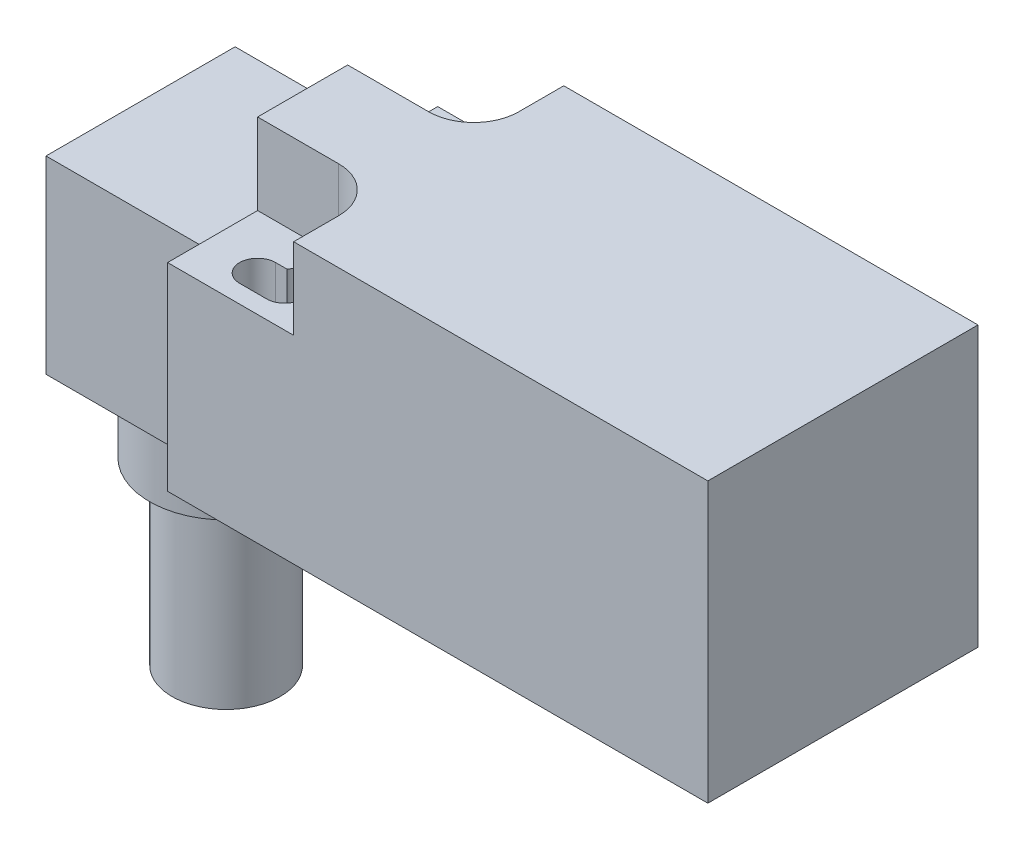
SolidWorks part; units mm, degrees
ref_plane "Plan de face" through (0, 0, 0) normal (0, 0, 1) x (1, 0, 0)
ref_plane "Plan de dessus" through (0, 0, 0) normal (0, 1, 0) x (1, 0, 0)
ref_plane "Plan de droite" through (0, 0, 0) normal (1, 0, 0) x (0, 0, -1)
sketch "Esquisse1" plane through (0, 0, 0) normal (0, 0, 1) x (1, 0, 0)
  line L1 (0, 15.5) -> (60, 15.5)
  line L2 (0, 15.5) -> (0, -15.5)
  line L3 (0, -15.5) -> (60, -15.5)
  line L4 (60, 15.5) -> (60, -15.5)
  dimension "D1" = 31
  dimension "D2" = 60
extrude "Extrusion1" add sketch "Esquisse1" along normal mid plane 30
sketch "Esquisse2" plane through (0, 15.5, 0) normal (0, 1, 0) x (-1, 0, 0)
  line L1 (0, -15) -> (-14, -15)
  line L2 (0, -15) -> (0, -5)
  line L3 (0, -5) -> (-9, -5)
  line L4 (-14, -15) -> (-14, -10)
  line L5 (0, 15) -> (-14, 15)
  line L6 (0, 15) -> (0, 5)
  line L7 (0, 5) -> (-9, 5)
  line L8 (-14, 15) -> (-14, 10)
  arc A0 (-9, -5) -> (-14, -10) centre (-9, -10) ccw
  arc A1 (-9, 5) -> (-14, 10) centre (-9, 10) cw
  point P12 (-14, 5)
  dimension "D4" = 5
  dimension "D1" = 10
  dimension "D2" = 10
  dimension "D3" = 14
extrude "Enlèv. mat.-Extru.1" cut sketch "Esquisse2" against normal blind 9
sketch "Esquisse3" plane through (0, -15.5, 0) normal (0, -1, 0) x (1, 0, 0)
  line L0 (0, 0) -> (31.5871, 0) construction
  line L1 (6, 13) -> (9, 13)
  line L2 (0, 15) -> (0, -15) construction
  line L3 (11, 10) -> (11, 11)
  line L4 (6, 9) -> (7.2679, 9)
  line L9 (6, -9) -> (7.2679, -9)
  line L10 (11, -10) -> (11, -11)
  line L11 (6, -13) -> (9, -13)
  arc A0 (7.2679, 9) -> (11, 10) centre (9, 10) ccw
  arc A1 (6, 13) -> (6, 9) centre (6, 11) ccw
  arc A2 (11, 11) -> (9, 13) centre (9, 11) ccw
  arc A6 (11, -11) -> (9, -13) centre (9, -11) cw
  arc A7 (6, -13) -> (6, -9) centre (6, -11) cw
  arc A8 (7.2679, -9) -> (11, -10) centre (9, -10) cw
  dimension "D1" = 6
  dimension "D2" = 2
  dimension "D7" = 20
  dimension "D3" = 2
  dimension "D4" = 3
  dimension "D5" = 1
  dimension "D6" = 22
extrude "Enlèv. mat.-Extru.2" cut sketch "Esquisse3" against normal through all
sketch "Esquisse4" plane through (0, 0, 0) normal (-1, 0, 0) x (0, 0, 1)
  line L0 (15, -15.5) -> (-15, -15.5) construction
  line L1 (-10.5, -15.5) -> (10.5, -15.5)
  line L2 (-10.5, -15.5) -> (-10.5, 5.5)
  line L3 (-10.5, 5.5) -> (10.5, 5.5)
  line L4 (10.5, -15.5) -> (10.5, 5.5)
  point P6 (0, -15.5)
  dimension "D1" = 21
  dimension "D2" = 21
extrude "Extrusion2" add sketch "Esquisse4" along normal blind 18 separate body
sketch "Esquisse5" plane through (0, -15.5, 0) normal (0, -1, 0) x (1, 0, 0)
  circle A0 centre (-8.5, 0) radius 8.5
  dimension "D1" = 17
  dimension "D2" = 8.5
extrude "Extrusion3" add sketch "Esquisse5" along normal blind 8.5 separate body
sketch "Esquisse6" plane through (0, -24, 0) normal (0, -1, 0) x (1, 0, 0)
  circle A0 centre (-8.5, 0) radius 6
  circle A1 centre (-8.5, 0) radius 4.25
  circle A5 centre (-8.5, 0) radius 8.5 construction
  dimension "D1" = 8.5
  dimension "D2" = 12
extrude "Extrusion4" add sketch "Esquisse6" along normal blind 20
